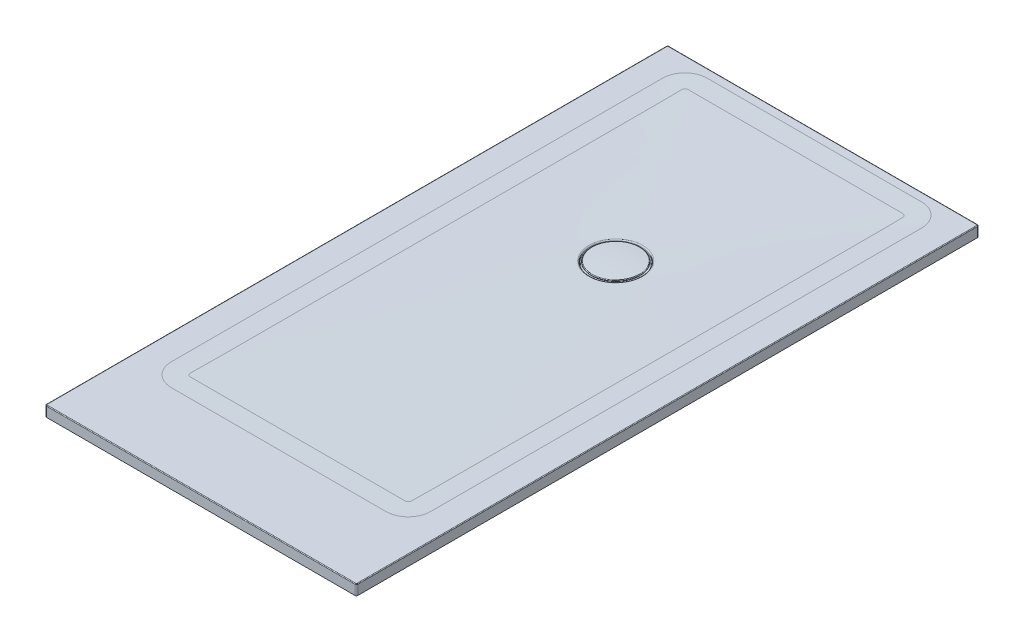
SolidWorks part; units mm, degrees
ref_plane "Płaszczyzna przednia" through (0, 0, 0) normal (0, 0, 1) x (1, 0, 0)
ref_plane "Płaszczyzna górna" through (0, 0, 0) normal (0, 1, 0) x (1, 0, 0)
ref_plane "Płaszczyzna prawa" through (0, 0, 0) normal (1, 0, 0) x (0, 0, -1)
sketch "Szkic2" plane through (0, 0, 0) normal (0, 1, 0) x (1, 0, 0)
  line L0 (0, 900) -> (0, 300) construction
  line L1 (-450, -900) -> (450, -900)
  line L2 (-450, -900) -> (-450, 900)
  line L3 (-450, 900) -> (450, 900)
  line L4 (450, -900) -> (450, 900)
  line L5 (-450, -900) -> (450, 900) construction
  line L6 (-450, 900) -> (450, -900) construction
  line L7 (-360, 860) -> (360, 860)
  line L8 (-360, 860) -> (-360, -660)
  line L9 (-360, -660) -> (360, -660)
  line L10 (360, 860) -> (360, -660)
  line L11 (-400, 900) -> (-400, -700) construction
  line L12 (-400, -700) -> (400, -700) construction
  line L13 (400, -700) -> (400, 900) construction
  circle A0 centre (0, 300) radius 75
  point P0 (0, 0)
  point P11 (0, 860)
  point P16 (0, -700)
  dimension "D9" = 150
  dimension "D1" = 900
  dimension "D2" = 1800
  dimension "D3" = 40
  dimension "D4" = 90
  dimension "D5" = 40
  dimension "D6" = 50
  dimension "D7" = 1600
  dimension "D8" = 600
  dimension "D10" = 800
sketch "Szkic3" plane through (0, 0, 0) normal (0, 1, 0) x (1, 0, 0)
  line L0 (-450, -900) -> (-450, 900) construction
  line L1 (-450, -900) -> (450, -900) construction
  line L2 (450, -900) -> (450, 900) construction
  line L3 (-450, 900) -> (450, 900) construction
  line L4 (-360, 860) -> (-360, -660) construction
  line L5 (-360, 860) -> (360, 860) construction
  line L6 (360, 860) -> (360, -660) construction
  line L7 (-360, -660) -> (360, -660) construction
  line L8 (-450, -900) -> (-450, 900)
  line L9 (-450, -900) -> (450, -900)
  line L10 (450, -900) -> (450, 900)
  line L11 (-450, 900) -> (450, 900)
  line L12 (-360, 810) -> (-360, -610)
  line L13 (-310, 860) -> (310, 860)
  line L14 (360, 810) -> (360, -610)
  line L15 (-310, -660) -> (310, -660)
  arc A0 (360, 810) -> (310, 860) centre (310, 810) ccw
  arc A1 (-310, 860) -> (-360, 810) centre (-310, 810) ccw
  arc A2 (310, -660) -> (360, -610) centre (310, -610) ccw
  arc A3 (-310, -660) -> (-360, -610) centre (-310, -610) cw
  dimension "D1" = 50
surface "Powierzchnia-Płaszczyzna1" sketch "Szkic3"
sketch "Szkic4" plane through (0, 0, 0) normal (0, 1, 0) x (1, 0, 0)
  line L0 (-360, 860) -> (-360, -660) construction
  line L1 (-360, -660) -> (360, -660) construction
  line L2 (360, 860) -> (360, -660) construction
  line L3 (-360, 860) -> (360, 860) construction
  line L4 (-360, 860) -> (-360, -660)
  line L5 (-360, -660) -> (360, -660)
  line L6 (360, 860) -> (360, -660)
  line L7 (-360, 860) -> (360, 860)
ref_plane "korek" through (0, -15, 0) normal (0, 1, 0) x (-1, 0, 0)
sketch "Szkic5" plane through (0, -15, 0) normal (0, 1, 0) x (-1, 0, 0)
  circle A0 centre (0, -300) radius 75 construction
  circle A1 centre (0, -300) radius 75
surface "Powierzchnia-Wyciągnięcie po profilach2"
surface "Powierzchnia-Połącz1"
sketch "Szkic7" plane through (0, 0, 0) normal (0, 1, 0) x (1, 0, 0)
  line L27 (310, 820) -> (-310, 820)
  line L28 (-320, 810) -> (-320, -610)
  line L29 (-310, -620) -> (310, -620)
  line L30 (320, -610) -> (320, 810)
  line L31 (310, 820) -> (-310, 820)
  line L32 (-320, 810) -> (-320, -610)
  line L33 (-310, -620) -> (310, -620)
  line L34 (320, -610) -> (320, 810)
  line L35 (310, 875) -> (-310, 875)
  line L36 (-375, 810) -> (-375, -610)
  line L37 (-310, -675) -> (310, -675)
  line L38 (375, -610) -> (375, 810)
  line L39 (310, 875) -> (-310, 875)
  line L40 (-375, 810) -> (-375, -610)
  line L41 (-310, -675) -> (310, -675)
  line L42 (375, -610) -> (375, 810)
  arc A0 (320, -610) -> (310, -620) centre (310, -610) cw
  arc A1 (-320, -610) -> (-310, -620) centre (-310, -610) ccw
  arc A2 (320, 810) -> (310, 820) centre (310, 810) ccw
  arc A3 (-320, 810) -> (-310, 820) centre (-310, 810) cw
  spline S23 degree 3 poles (-634.3712, 511.3807) (27.753, 670.1675) (328.7105, 767.444) (319.7445, 812.2675) (319.6661, 812.5843) (319.4756, 813.2121) (319.3642, 813.5243) (318.988, 814.432) (318.6813, 815.0062) (318.1377, 815.821) (317.9418, 816.0858) (317.5239, 816.5953) (317.3041, 816.8378) (316.6128, 817.5297) (316.1098, 817.9436) (315.2909, 818.4921) (315.007, 818.6623) (314.4302, 818.9711) (314.1357, 819.1105) (313.5346, 819.3603) (313.2279, 819.4702) (312.6027, 819.6612) (312.2822, 819.7411) (311.6364, 819.8713) (311.3115, 819.9186) (310.8217, 819.9668) (310.6581, 819.9803) (298.3868, 820.6094) (282.909, 790.978) (385.0559, 1817.0824) knots -8.587127 -8.587127 -8.587127 -8.587127 0.125 0.125 0.1875 0.1875 0.25 0.25 0.375 0.375 0.4375 0.4375 0.5 0.5 0.625 0.625 0.6875 0.6875 0.75 0.75 0.8125 0.8125 0.875 0.875 0.9375 0.9375 0.96875 0.96875 3.273841 3.273841 3.273841 3.273841 only from (320, 810) to (310, 820)
  spline S24 degree 3 poles (-442.6311, 1811.1647) (-281.0854, 790.952) (-298.368, 820.6093) (-310.657, 819.9804) (-310.8198, 819.967) (-311.3068, 819.9191) (-311.629, 819.8724) (-312.2675, 819.7444) (-312.5844, 819.6661) (-313.2122, 819.4756) (-313.5244, 819.3642) (-314.4321, 818.988) (-315.0062, 818.6813) (-316.0927, 817.9564) (-316.6073, 817.5345) (-317.5296, 816.6128) (-317.9436, 816.1098) (-318.4921, 815.2909) (-318.6623, 815.0071) (-318.9711, 814.4303) (-319.1105, 814.1357) (-319.3602, 813.5347) (-319.4701, 813.228) (-319.6611, 812.6027) (-319.7411, 812.2824) (-336.4748, 729.1052) (732.3701, 525.3654) (-1309.8771, 668.0848) knots -2.28415 -2.28415 -2.28415 -2.28415 0.03125 0.03125 0.0625 0.0625 0.125 0.125 0.1875 0.1875 0.25 0.25 0.375 0.375 0.5 0.5 0.625 0.625 0.6875 0.6875 0.75 0.75 0.8125 0.8125 0.875 0.875 16.910394 16.910394 16.910394 16.910394 only from (-310, 820) to (-320, 810)
  spline S25 degree 3 poles (634.3716, -311.3806) (-27.753, -470.1675) (-328.7105, -567.444) (-319.7445, -612.2675) (-319.6661, -612.5843) (-319.4756, -613.2121) (-319.3642, -613.5243) (-318.988, -614.432) (-318.6813, -615.0062) (-318.1377, -615.821) (-317.9418, -616.0858) (-317.5239, -616.5953) (-317.3041, -616.8378) (-316.6128, -617.5297) (-316.1098, -617.9436) (-315.2909, -618.4921) (-315.007, -618.6623) (-314.4302, -618.9711) (-314.1357, -619.1105) (-313.5346, -619.3603) (-313.2279, -619.4702) (-312.6027, -619.6612) (-312.2822, -619.7411) (-311.6364, -619.8713) (-311.3115, -619.9186) (-310.8217, -619.9668) (-310.6581, -619.9803) (-298.3868, -620.6094) (-282.909, -590.978) (-385.0559, -1617.0824) knots -8.587127 -8.587127 -8.587127 -8.587127 0.125 0.125 0.1875 0.1875 0.25 0.25 0.375 0.375 0.4375 0.4375 0.5 0.5 0.625 0.625 0.6875 0.6875 0.75 0.75 0.8125 0.8125 0.875 0.875 0.9375 0.9375 0.96875 0.96875 3.273841 3.273841 3.273841 3.273841 only from (-320, -610) to (-310, -620)
  spline S26 degree 3 poles (442.6311, -1611.1646) (281.0854, -590.952) (298.368, -620.6093) (310.657, -619.9804) (310.8198, -619.967) (311.3068, -619.9191) (311.629, -619.8724) (312.2675, -619.7444) (312.5844, -619.6661) (313.2122, -619.4756) (313.5244, -619.3642) (314.4321, -618.988) (315.0062, -618.6813) (316.0927, -617.9564) (316.6073, -617.5345) (317.5296, -616.6128) (317.9436, -616.1098) (318.4921, -615.2909) (318.6623, -615.0071) (318.9711, -614.4303) (319.1105, -614.1357) (319.3602, -613.5347) (319.4701, -613.228) (319.6611, -612.6027) (319.7411, -612.2824) (336.4748, -529.1052) (-732.3701, -325.3654) (1309.8771, -468.0848) knots -2.28415 -2.28415 -2.28415 -2.28415 0.03125 0.03125 0.0625 0.0625 0.125 0.125 0.1875 0.1875 0.25 0.25 0.375 0.375 0.5 0.5 0.625 0.625 0.6875 0.6875 0.75 0.75 0.8125 0.8125 0.875 0.875 16.910394 16.910394 16.910394 16.910394 only from (310, -620) to (320, -610)
  spline S31 degree 3 poles (-2473.3465, -93.4682) (-38.566, 462.8577) (388.4058, 677.1565) (374.4773, 818.4945) (374.1672, 820.5876) (373.3418, 824.7388) (372.8285, 826.7973) (371.9014, 829.8582) (371.5658, 830.8757) (370.8441, 832.8943) (370.4597, 833.8906) (368.4227, 838.8081) (366.4285, 842.54) (363.4837, 846.9543) (362.8719, 847.8245) (361.6022, 849.5393) (360.9423, 850.386) (358.9053, 852.8701) (357.4763, 854.4464) (352.9828, 858.9433) (349.7136, 861.6339) (345.2775, 864.6044) (344.37, 865.1801) (342.5355, 866.2813) (341.6081, 866.8072) (338.796, 868.3123) (336.8814, 869.2187) (332.9741, 870.8414) (330.9811, 871.5572) (327.9324, 872.4866) (326.9062, 872.7721) (324.8334, 873.2936) (323.785, 873.5302) (320.6362, 874.1603) (318.5251, 874.4734) (315.3412, 874.7882) (314.2772, 874.8686) (181.7244, 881.452) (3.6385, 468.5173) (247.718, 3855.6459) knots -4.060629 -4.060629 -4.060629 -4.060629 0.0625 0.0625 0.125 0.125 0.1875 0.1875 0.21875 0.21875 0.25 0.25 0.375 0.375 0.40625 0.40625 0.4375 0.4375 0.5 0.5 0.625 0.625 0.65625 0.65625 0.6875 0.6875 0.75 0.75 0.8125 0.8125 0.84375 0.84375 0.875 0.875 0.9375 0.9375 0.96875 0.96875 4.819452 4.819452 4.819452 4.819452 only from (375, 810) to (310, 875)
  spline S32 degree 3 poles (-405.3768, 3852.7663) (38.9785, 432.714) (-175.9492, 881.7287) (-314.2695, 874.8691) (-315.3288, 874.7892) (-318.4945, 874.477) (-320.5877, 874.1675) (-324.7388, 873.3417) (-326.7972, 872.8286) (-329.8581, 871.9015) (-330.8756, 871.5658) (-332.8943, 870.8441) (-333.8906, 870.4598) (-338.8081, 868.4227) (-342.54, 866.4285) (-346.9543, 863.4837) (-347.8245, 862.872) (-349.5392, 861.6022) (-350.3859, 860.9424) (-352.8701, 858.9054) (-354.4464, 857.4764) (-358.9432, 852.9828) (-361.6339, 849.7137) (-364.6043, 845.2776) (-365.18, 844.3702) (-366.2812, 842.5356) (-366.8071, 841.6082) (-368.3122, 838.796) (-369.2187, 836.8815) (-370.8414, 832.9742) (-371.5571, 830.9812) (-372.4865, 827.9326) (-372.772, 826.9064) (-373.2937, 824.8337) (-373.5301, 823.7853) (-374.16, 820.6363) (-374.4737, 818.5252) (-389.6703, 664.7631) (121.2082, 454.7325) (2509.6807, 36.2174) knots -4.000158 -4.000158 -4.000158 -4.000158 0.03125 0.03125 0.0625 0.0625 0.125 0.125 0.1875 0.1875 0.21875 0.21875 0.25 0.25 0.375 0.375 0.40625 0.40625 0.4375 0.4375 0.5 0.5 0.625 0.625 0.65625 0.65625 0.6875 0.6875 0.75 0.75 0.8125 0.8125 0.84375 0.84375 0.875 0.875 0.9375 0.9375 5.402471 5.402471 5.402471 5.402471 only from (-310, 875) to (-375, 810)
  spline S33 degree 3 poles (2473.3466, 293.4683) (38.566, -262.8577) (-388.4058, -477.1565) (-374.4773, -618.4945) (-374.1672, -620.5876) (-373.3418, -624.7388) (-372.8285, -626.7973) (-371.9014, -629.8582) (-371.5658, -630.8757) (-370.8441, -632.8943) (-370.4597, -633.8906) (-368.4227, -638.8081) (-366.4285, -642.54) (-363.4837, -646.9543) (-362.8719, -647.8245) (-361.6022, -649.5393) (-360.9423, -650.386) (-358.9053, -652.8701) (-357.4763, -654.4464) (-352.9828, -658.9433) (-349.7136, -661.6339) (-345.2775, -664.6044) (-344.37, -665.1801) (-342.5355, -666.2813) (-341.6081, -666.8072) (-338.796, -668.3123) (-336.8814, -669.2187) (-332.9741, -670.8414) (-330.9811, -671.5572) (-327.9324, -672.4866) (-326.9062, -672.7721) (-324.8334, -673.2936) (-323.785, -673.5302) (-320.6362, -674.1603) (-318.5251, -674.4734) (-315.3412, -674.7882) (-314.2772, -674.8686) (-181.7244, -681.452) (-3.6385, -268.5173) (-247.718, -3655.646) knots -4.060629 -4.060629 -4.060629 -4.060629 0.0625 0.0625 0.125 0.125 0.1875 0.1875 0.21875 0.21875 0.25 0.25 0.375 0.375 0.40625 0.40625 0.4375 0.4375 0.5 0.5 0.625 0.625 0.65625 0.65625 0.6875 0.6875 0.75 0.75 0.8125 0.8125 0.84375 0.84375 0.875 0.875 0.9375 0.9375 0.96875 0.96875 4.819452 4.819452 4.819452 4.819452 only from (-375, -610) to (-310, -675)
  spline S34 degree 3 poles (405.3768, -3652.7666) (-38.9785, -232.714) (175.9492, -681.7287) (314.2695, -674.8691) (315.3288, -674.7892) (318.4945, -674.477) (320.5877, -674.1675) (324.7388, -673.3417) (326.7972, -672.8286) (329.8581, -671.9015) (330.8756, -671.5658) (332.8943, -670.8441) (333.8906, -670.4598) (338.8081, -668.4227) (342.54, -666.4285) (346.9543, -663.4837) (347.8245, -662.872) (349.5392, -661.6022) (350.3859, -660.9424) (352.8701, -658.9054) (354.4464, -657.4764) (358.9432, -652.9828) (361.6339, -649.7137) (364.6043, -645.2776) (365.18, -644.3702) (366.2812, -642.5356) (366.8071, -641.6082) (368.3122, -638.796) (369.2187, -636.8815) (370.8414, -632.9742) (371.5571, -630.9812) (372.4865, -627.9326) (372.772, -626.9064) (373.2937, -624.8337) (373.5301, -623.7853) (374.16, -620.6363) (374.4737, -618.5252) (389.6703, -464.7631) (-121.2082, -254.7325) (-2509.6807, 163.7826) knots -4.000158 -4.000158 -4.000158 -4.000158 0.03125 0.03125 0.0625 0.0625 0.125 0.125 0.1875 0.1875 0.21875 0.21875 0.25 0.25 0.375 0.375 0.40625 0.40625 0.4375 0.4375 0.5 0.5 0.625 0.625 0.65625 0.65625 0.6875 0.6875 0.75 0.75 0.8125 0.8125 0.84375 0.84375 0.875 0.875 0.9375 0.9375 5.402471 5.402471 5.402471 5.402471 only from (310, -675) to (375, -610)
  spline S35 degree 3 poles (375, 810) (375, 812.1459) (374.8933, 814.2736) (374.4773, 818.4945) (374.1672, 820.5876) (373.3418, 824.7388) (372.8285, 826.7973) (371.9014, 829.8582) (371.5658, 830.8757) (370.8441, 832.8943) (370.4597, 833.8906) (368.4227, 838.8081) (366.4285, 842.54) (363.4837, 846.9543) (362.8719, 847.8245) (361.6022, 849.5393) (360.9423, 850.386) (358.9053, 852.8701) (357.4763, 854.4464) (352.9828, 858.9433) (349.7136, 861.6339) (345.2775, 864.6044) (344.37, 865.1801) (342.5355, 866.2813) (341.6081, 866.8072) (338.796, 868.3123) (336.8814, 869.2187) (332.9741, 870.8414) (330.9811, 871.5572) (327.9324, 872.4866) (326.9062, 872.7721) (324.8334, 873.2936) (323.785, 873.5302) (320.6362, 874.1603) (318.5251, 874.4734) (315.3412, 874.7882) (314.2772, 874.8686) (312.1431, 874.9746) (311.0729, 875) (310, 875) knots 0 0 0 0 0.0625 0.0625 0.125 0.125 0.1875 0.1875 0.21875 0.21875 0.25 0.25 0.375 0.375 0.40625 0.40625 0.4375 0.4375 0.5 0.5 0.625 0.625 0.65625 0.65625 0.6875 0.6875 0.75 0.75 0.8125 0.8125 0.84375 0.84375 0.875 0.875 0.9375 0.9375 0.96875 0.96875 1 1 1 1
  spline S36 degree 3 poles (-310, 875) (-311.073, 875) (-312.1416, 874.9746) (-314.2695, 874.8691) (-315.3288, 874.7892) (-318.4945, 874.477) (-320.5877, 874.1675) (-324.7388, 873.3417) (-326.7972, 872.8286) (-329.8581, 871.9015) (-330.8756, 871.5658) (-332.8943, 870.8441) (-333.8906, 870.4598) (-338.8081, 868.4227) (-342.54, 866.4285) (-346.9543, 863.4837) (-347.8245, 862.872) (-349.5392, 861.6022) (-350.3859, 860.9424) (-352.8701, 858.9054) (-354.4464, 857.4764) (-358.9432, 852.9828) (-361.6339, 849.7137) (-364.6043, 845.2776) (-365.18, 844.3702) (-366.2812, 842.5356) (-366.8071, 841.6082) (-368.3122, 838.796) (-369.2187, 836.8815) (-370.8414, 832.9742) (-371.5571, 830.9812) (-372.4865, 827.9326) (-372.772, 826.9064) (-373.2937, 824.8337) (-373.5301, 823.7853) (-374.16, 820.6363) (-374.4737, 818.5252) (-374.8933, 814.28) (-375, 812.1459) (-375, 810) knots 0 0 0 0 0.03125 0.03125 0.0625 0.0625 0.125 0.125 0.1875 0.1875 0.21875 0.21875 0.25 0.25 0.375 0.375 0.40625 0.40625 0.4375 0.4375 0.5 0.5 0.625 0.625 0.65625 0.65625 0.6875 0.6875 0.75 0.75 0.8125 0.8125 0.84375 0.84375 0.875 0.875 0.9375 0.9375 1 1 1 1
  spline S37 degree 3 poles (-375, -610) (-375, -612.1459) (-374.8933, -614.2736) (-374.4773, -618.4945) (-374.1672, -620.5876) (-373.3418, -624.7388) (-372.8285, -626.7973) (-371.9014, -629.8582) (-371.5658, -630.8757) (-370.8441, -632.8943) (-370.4597, -633.8906) (-368.4227, -638.8081) (-366.4285, -642.54) (-363.4837, -646.9543) (-362.8719, -647.8245) (-361.6022, -649.5393) (-360.9423, -650.386) (-358.9053, -652.8701) (-357.4763, -654.4464) (-352.9828, -658.9433) (-349.7136, -661.6339) (-345.2775, -664.6044) (-344.37, -665.1801) (-342.5355, -666.2813) (-341.6081, -666.8072) (-338.796, -668.3123) (-336.8814, -669.2187) (-332.9741, -670.8414) (-330.9811, -671.5572) (-327.9324, -672.4866) (-326.9062, -672.7721) (-324.8334, -673.2936) (-323.785, -673.5302) (-320.6362, -674.1603) (-318.5251, -674.4734) (-315.3412, -674.7882) (-314.2772, -674.8686) (-312.1431, -674.9746) (-311.0729, -675) (-310, -675) knots 0 0 0 0 0.0625 0.0625 0.125 0.125 0.1875 0.1875 0.21875 0.21875 0.25 0.25 0.375 0.375 0.40625 0.40625 0.4375 0.4375 0.5 0.5 0.625 0.625 0.65625 0.65625 0.6875 0.6875 0.75 0.75 0.8125 0.8125 0.84375 0.84375 0.875 0.875 0.9375 0.9375 0.96875 0.96875 1 1 1 1
  spline S38 degree 3 poles (310, -675) (311.073, -675) (312.1416, -674.9746) (314.2695, -674.8691) (315.3288, -674.7892) (318.4945, -674.477) (320.5877, -674.1675) (324.7388, -673.3417) (326.7972, -672.8286) (329.8581, -671.9015) (330.8756, -671.5658) (332.8943, -670.8441) (333.8906, -670.4598) (338.8081, -668.4227) (342.54, -666.4285) (346.9543, -663.4837) (347.8245, -662.872) (349.5392, -661.6022) (350.3859, -660.9424) (352.8701, -658.9054) (354.4464, -657.4764) (358.9432, -652.9828) (361.6339, -649.7137) (364.6043, -645.2776) (365.18, -644.3702) (366.2812, -642.5356) (366.8071, -641.6082) (368.3122, -638.796) (369.2187, -636.8815) (370.8414, -632.9742) (371.5571, -630.9812) (372.4865, -627.9326) (372.772, -626.9064) (373.2937, -624.8337) (373.5301, -623.7853) (374.16, -620.6363) (374.4737, -618.5252) (374.8933, -614.28) (375, -612.1459) (375, -610) knots 0 0 0 0 0.03125 0.03125 0.0625 0.0625 0.125 0.125 0.1875 0.1875 0.21875 0.21875 0.25 0.25 0.375 0.375 0.40625 0.40625 0.4375 0.4375 0.5 0.5 0.625 0.625 0.65625 0.65625 0.6875 0.6875 0.75 0.75 0.8125 0.8125 0.84375 0.84375 0.875 0.875 0.9375 0.9375 1 1 1 1
  dimension "D3" = 10
  dimension "D1" = 40
  dimension "D2" = 15
other "Usuń ścianę1"
other "Granica-Powierzchnia1"
surface "Powierzchnia-Połącz2"
sketch "Szkic9" plane through (0, 0, 0) normal (0, 1, 0) x (1, 0, 0)
  line L0 (-450, -900) -> (450, -900) construction
  line L1 (-450, -900) -> (-450, 900) construction
  line L2 (450, -900) -> (450, 900) construction
  line L3 (-450, 900) -> (450, 900) construction
  line L4 (-450, -900) -> (450, -900)
  line L5 (-450, -900) -> (-450, 900)
  line L6 (450, -900) -> (450, 900)
  line L7 (-450, 900) -> (450, 900)
surface "Powierzchnia-Wyciągnięcie1" sketch "Szkic9" parameters "D1"=30
sketch "Szkic8" plane through (0, 0, 0) normal (1, 0, 0) x (0, 0, -1)
  line L0 (300, 0) -> (300, -30) construction
  line L1 (225, -15) -> (225.2968, -23.5)
  line L4 (225.2968, -23.5) -> (248, -24.0945)
  line L5 (225.2968, -23.5) -> (300, -23.5) construction
  line L6 (248, -24.0945) -> (248, -30) construction
  line L7 (300, -30) -> (225.2968, -30) construction
  line L8 (225.2968, -30) -> (225.2968, -23.5) construction
  line L9 (255, -28) -> (255, -30)
  line L10 (248, -24.0945) -> (255, -28)
  dimension "D1" = 30
  dimension "D2" = 8.5
  dimension "D3" = 2
  dimension "D4" = 1.5
  dimension "D5" = 52
  dimension "D6" = 45
  dimension "D7" = 2
surface "Powierzchnia-Obrót1" sketch "Szkic8" parameters "D1"=360
surface "Powierzchnia-Płaszczyzna2"
surface "Powierzchnia-Połącz3"
fillet "Zaokrąglenie4" radius 4 4 edges at (-450, -15, -900) (450, -15, -900) (-450, -15, 900) (450, -15, 900)
fillet "Zaokrąglenie5" radius 3 3 edges at (0, -24.0945, -352) (0, -23.5, -374.7032)
fillet "Zaokrąglenie6" radius 2 9 edges at (448.8284, 0, 898.8284) (0, 0, 900) (-448.8284, 0, 898.8284) (-450, 0, 0) (-448.8284, 0, -898.8284) (0, 0, -900) (448.8284, 0, -898.8284) (450, 0, 0) (0, -28, -345)
sketch "Szkic11" plane through (0, 0, 0) normal (1, 0, 0) x (0, 0, -1)
  line L0 (300, 0) -> (300, -30) construction
  line L1 (-896, -30) -> (896, -30) construction
  line L2 (300, -17) -> (300, -11.5)
  line L14 (370, -11.5) -> (370, -14.5) construction
  line L16 (370, -17) -> (300, -17)
  line L18 (370, -17) -> (370, -16.3377)
  line L19 (300, -11.5) -> (370, -11.5) construction
  arc A0 (370, -16.3377) -> (368.1666, -14.3446) centre (368, -16.3377) ccw
  arc A6 (368.1666, -14.3446) -> (300, -11.5) centre (300, -829.6667) ccw
  dimension "D2" = 2
  dimension "D8" = 2.5
  dimension "D9" = 17
  dimension "D10" = 5.5
  dimension "D11" = 70
revolve "Obrót1" add sketch "Szkic11" angle 360 about L0
